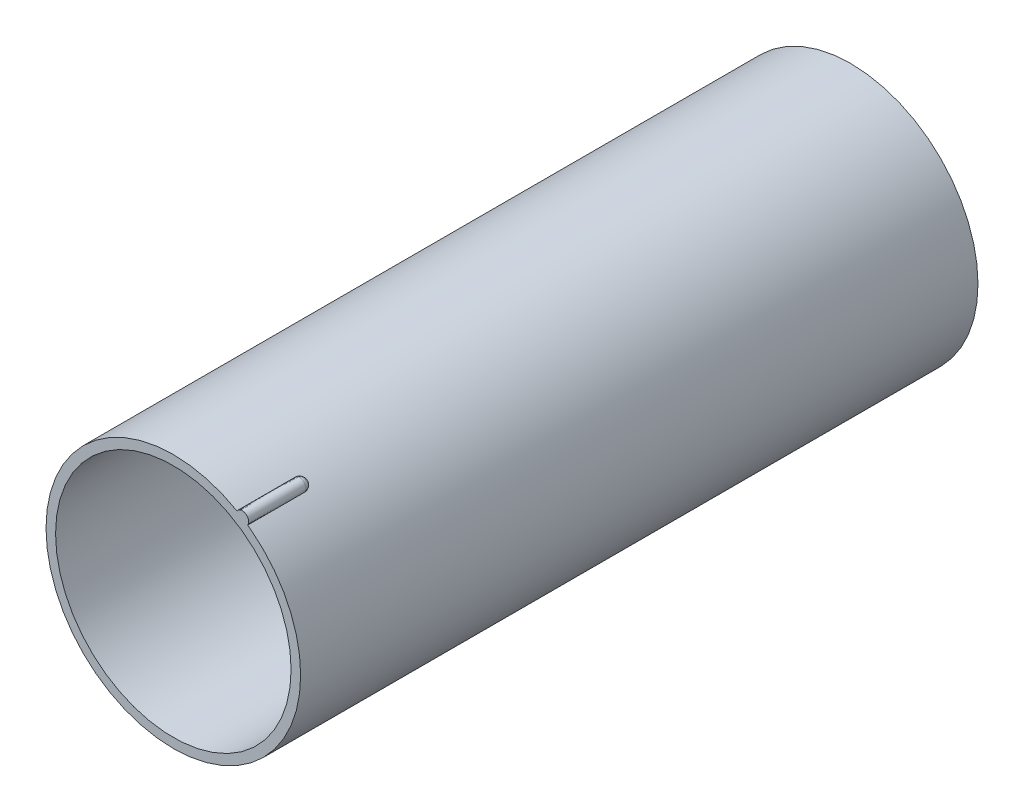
SolidWorks part; units mm, degrees
ref_plane "Спереди" through (0, 0, 0) normal (0, 0, 1) x (1, 0, 0)
ref_plane "Сверху" through (0, 0, 0) normal (0, 1, 0) x (1, 0, 0)
ref_plane "Справа" through (0, 0, 0) normal (1, 0, 0) x (0, 0, -1)
sketch "Эскиз2" plane through (0, 0, 0) normal (0, 0, 1) x (1, 0, 0)
  circle A0 centre (0, 0) radius 20
  circle A1 centre (0, 0) radius 18.5
  dimension "D1" = 40
  dimension "D2" = 37
extrude "Бобышка-Вытянуть1" add sketch "Эскиз2" along normal blind 106.4
sketch "Эскиз5" plane through (0, 0, 0) normal (0, 0, -1) x (-1, 0, 0)
  line L0 (0, 0) -> (0, 18.5) construction
  line L1 (0, 0) -> (2.9901, 18.2568) construction
  line L2 (0, 18.5) -> (0, 9.2195)
  line L3 (2.9901, 18.2568) -> (1.4901, 9.0983)
  circle A0 centre (0, 0) radius 18.5 construction
  arc A1 (0, 18.5) -> (2.9901, 18.2568) centre (0, 0) cw
  arc A2 (1.4901, 9.0983) -> (3.3687, 3.6948) centre (7.4112, 8.1286) ccw
  circle A3 centre (0, 0) radius 3
  arc A4 (-2.7273, 4.1907) -> (3.3687, 3.6948) centre (0, 0) ccw
  arc A5 (0, 9.2195) -> (-2.7273, 4.1907) centre (-6, 9.2195) cw
  point P16 (0, 5)
  dimension "D2" = 5
  dimension "D3" = 6
  dimension "D4" = 6
  dimension "D1" = 3
extrude "Бобышка-Вытянуть3" add sketch "Эскиз5" against normal through all
sketch "Sketch1" plane through (0, 0, 0) normal (0, 0, -1) x (-1, 0, 0)
  circle A0 centre (0, 0) radius 18.5
  arc A1 (0, 18.5) -> (2.9901, 18.2568) centre (0, 0) ccw construction
extrude "Cut-Extrude1" cut sketch "Sketch1" against normal blind 59
sketch "Sketch2" plane through (0, 0, 106.4) normal (0, 0, 1) x (1, 0, 0)
  circle A0 centre (0, 0) radius 18.5
  arc A1 (-2.9901, 18.2568) -> (0, 18.5) centre (0, 0) ccw construction
extrude "Cut-Extrude2" cut sketch "Sketch2" against normal blind 39
sketch "Sketch4" plane through (0, 0, 106.4) normal (0, 0, 1) x (1, 0, 0)
  line L0 (0, 0) -> (0, 18.5) construction
  line L1 (0, 18.5) -> (9.25, 16.0215) construction
  line L2 (9.25, 16.0215) -> (0, 0) construction
  line L3 (9.25, 16.0215) -> (10, 17.3205) construction
  line L4 (10, 17.3205) -> (11.6799, 16.2352)
  circle A0 centre (0, 0) radius 18.5 construction
  circle A1 centre (0, 0) radius 20 construction
  arc A2 (10, 17.3205) -> (11.6799, 16.2352) centre (10.8399, 16.7778) cw
  dimension "D2" = 1
  dimension "D1" = 30
  dimension "D3" = 2
extrude "Boss-Extrude2" add sketch "Sketch4" against normal blind 10
fillet "Fillet1" radius 1 1 edges at (11.3826, 17.6178, 96.4)
